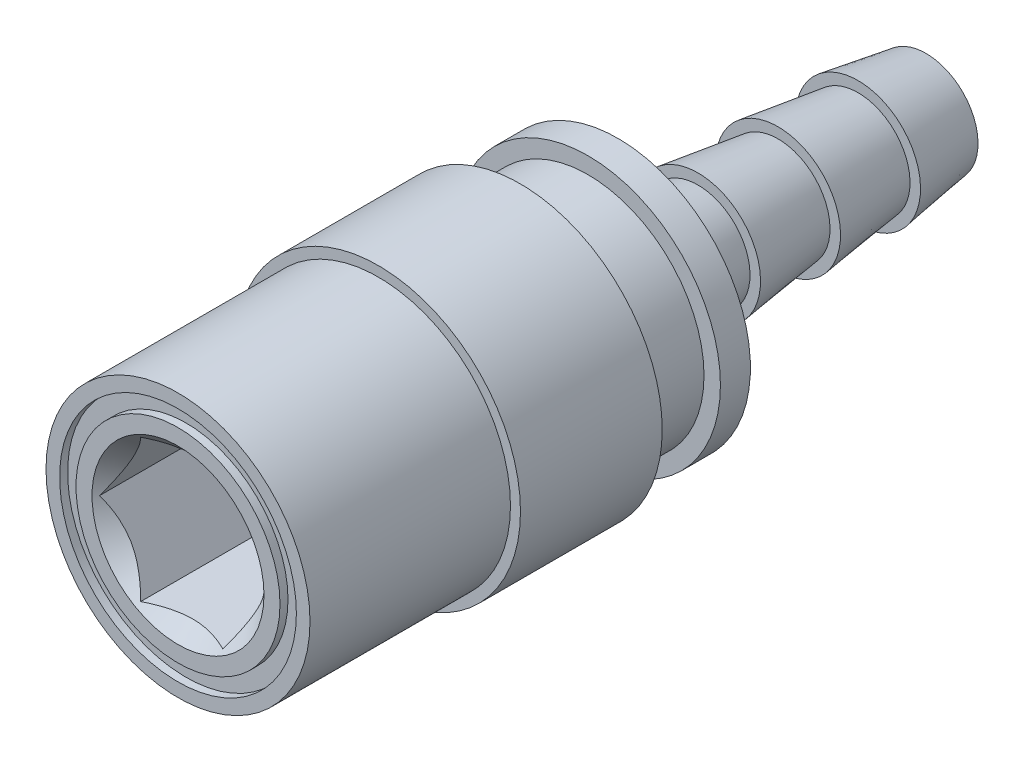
SolidWorks part; units mm, degrees
ref_plane "Front Plane" through (0, 0, 0) normal (0, 0, 1) x (1, 0, 0)
ref_plane "Top Plane" through (0, 0, 0) normal (0, 1, 0) x (1, 0, 0)
ref_plane "Right Plane" through (0, 0, 0) normal (1, 0, 0) x (0, 0, -1)
sketch "Sketch2" plane through (0, 0, 0) normal (0, 0, 1) x (1, 0, 0)
  circle A0 centre (0, 0) radius 9.017
  dimension "D1" = 18.034
extrude "Boss-Extrude1" add sketch "Sketch2" against normal blind 27.94
sketch "Sketch6" plane through (0, 0, 0) normal (1, 0, 0) x (0, 0, -1)
  line L1 (26.035, 7.366) -> (21.7297, 7.366)
  line L2 (26.035, 7.366) -> (26.035, 27.366)
  line L3 (26.035, 27.366) -> (21.7297, 27.366)
  line L4 (21.7297, 7.366) -> (21.7297, 27.366)
  line L5 (0, 0) -> (27.94, 0) construction
  line L7 (27.94, -9.017) -> (27.94, 9.017) construction
  dimension "D1" = 14.732
  dimension "D2" = 4.3053
  dimension "D3" = 20
  dimension "D4" = 1.905
revolve "Cut-Revolve1" cut sketch "Sketch6" angle 360 about L5
sketch "Sketch11" plane through (0, 0, 0) normal (0, 0, 1) x (1, 0, 0)
  circle A1 centre (0, 0) radius 6.477
  circle A2 centre (0, 0) radius 7.517
  circle A3 centre (0, 0) radius 7.517
  dimension "D2" = 12.954
  dimension "D1" = 1.5
extrude "Cut-Extrude3" cut sketch "Sketch11" against normal blind 0.508
sketch "Sketch27" plane through (0, 0, 0) normal (1, 0, 0) x (0, 0, -1)
  line L0 (21.7297, -9.017) -> (21.7297, 9.017) construction
  line L1 (0, 9.017) -> (12.7297, 9.017)
  line L2 (0, 9.017) -> (0, 8.382)
  line L3 (0, 8.382) -> (12.7297, 8.382)
  line L4 (12.7297, 9.017) -> (12.7297, 8.382)
  line L5 (0, 0) -> (21.7297, 0) construction
  line L6 (21.7297, -7.366) -> (21.7297, 7.366) construction
  dimension "D1" = 9
  dimension "D2" = 16.764
revolve "Cut-Revolve5" cut sketch "Sketch27" angle 360 about L5
sketch "Sketch32" plane through (0, 0, -27.94) normal (0, 0, -1) x (-1, 0, 0)
  circle A0 centre (0, 0) radius 8.4074
  dimension "D1" = 16.8148
extrude "Cut-Extrude4" cut sketch "Sketch32" against normal blind 2.54 flip side to cut
sketch "Sketch31" plane through (0, 0, 0) normal (1, 0, 0) x (0, 0, -1)
  line L0 (81.6783, 0) -> (47.498, 0) construction
  line L1 (27.94, -9.017) -> (27.94, 9.017) construction
  line L6 (27.94, 3.302) -> (47.498, 3.302) construction
  line L8 (27.94, 3.9687) -> (60.6393, 3.9687) construction
  line L10 (47.498, 3.302) -> (43.18, 3.9687)
  line L11 (43.18, 3.9687) -> (43.18, 3.302)
  line L12 (43.18, 3.302) -> (38.1, 3.9687)
  line L13 (38.1, 3.9687) -> (38.1, 3.302)
  line L14 (38.1, 3.302) -> (33.02, 3.9687)
  line L15 (33.02, 3.9687) -> (33.02, 3.302)
  line L16 (33.02, 3.302) -> (27.94, 3.9687)
  line L18 (27.94, 3.9687) -> (27.94, 0)
  line L19 (27.94, 0) -> (47.498, 0)
  line L20 (47.498, 3.302) -> (47.498, 0)
  line L22 (0, 8.382) -> (0, -8.382) construction
  dimension "D1" = 47.498
  dimension "D2" = 5.08
  dimension "D3" = 3.302
  dimension "D4" = 3.9688
revolve "Revolve4" add sketch "Sketch31" angle 360 about L19
sketch "Sketch29" plane through (0, 0, 0) normal (1, 0, 0) x (0, 0, -1)
  line L0 (0, 0) -> (47.498, 0)
  line L1 (47.498, -3.302) -> (47.498, 3.302) construction
  line L2 (26.035, 3.9688) -> (26.035, 2.3876)
  line L3 (12.7297, 4.445) -> (0, 4.445)
  line L4 (0, 8.382) -> (0, -8.382) construction
  line L5 (0, 4.445) -> (0, 0)
  line L6 (-3.9478, 0) -> (51.6563, 0) construction
  line L7 (12.7297, 4.445) -> (12.7297, 3.9688)
  line L8 (12.7297, 3.9688) -> (26.035, 3.9688)
  line L9 (12.7297, 9.017) -> (12.7297, -9.017) construction
  line L10 (26.035, 7.366) -> (26.035, -7.366) construction
  line L13 (26.035, 2.3876) -> (47.498, 2.3876)
  line L18 (47.498, 2.3876) -> (47.498, 0)
  dimension "D1" = 8.89
  dimension "D2" = 4.7752
  dimension "D3" = 7.9375
revolve "Cut-Revolve7" cut sketch "Sketch29" angle 360 about L6
chamfer "Chamfer1" distance 1.016 angle 45 1 edges at (4.445, 0, 0)
sketch "Sketch33" plane through (0, 0, 0) normal (0, 0, 1) x (1, 0, 0)
  line L1 (-2.6103, 4.5212) -> (-5.2206, 0)
  line L2 (-5.2206, 0) -> (-2.6103, -4.5212)
  line L3 (-2.6103, -4.5212) -> (2.6103, -4.5212)
  line L4 (2.6103, -4.5212) -> (5.2206, 0)
  line L5 (5.2206, 0) -> (2.6103, 4.5212)
  line L6 (2.6103, 4.5212) -> (-2.6103, 4.5212)
  circle A0 centre (0, 0) radius 4.5212 construction
  dimension "D1" = 9.0424
extrude "Cut-Extrude5" cut sketch "Sketch33" against normal up to surface (12.7297 mm away) contours L1 L2 L3 L4 L5 L6
